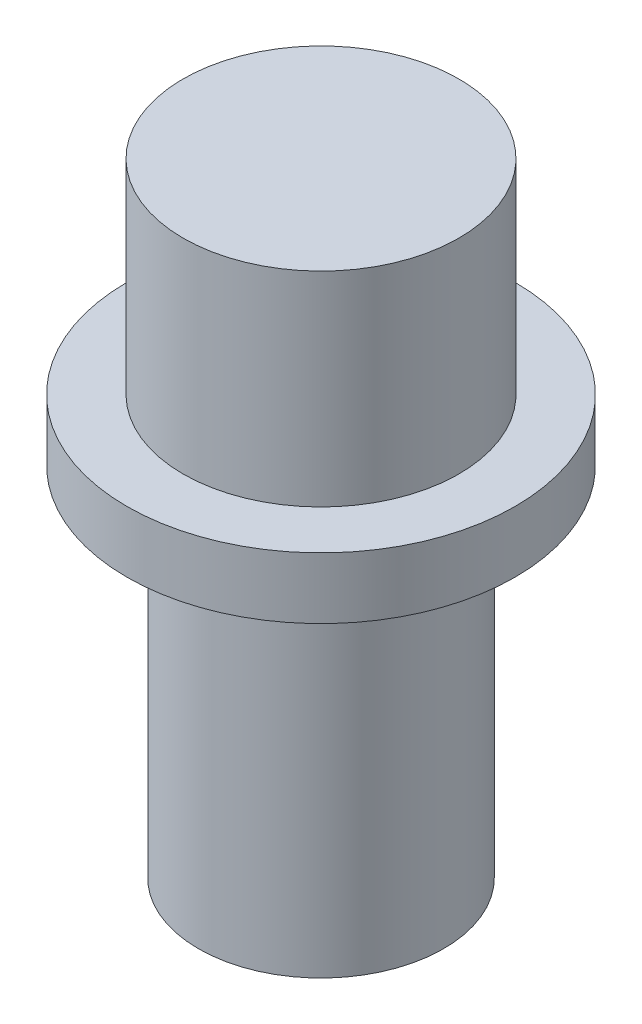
SolidWorks part; units mm, degrees
ref_plane "Front Plane" through (0, 0, 0) normal (0, 0, 1) x (1, 0, 0)
ref_plane "Top Plane" through (0, 0, 0) normal (0, 1, 0) x (1, 0, 0)
ref_plane "Right Plane" through (0, 0, 0) normal (1, 0, 0) x (0, 0, -1)
sketch "Sketch1" plane through (0, 0, 0) normal (0, 1, 0) x (1, 0, 0)
  circle A0 centre (0, 0) radius 12
  dimension "24" = 24
extrude "Boss-Extrude1" add sketch "Sketch1" along normal blind 35
sketch "Sketch2" plane through (0, 35, 0) normal (0, 1, 0) x (1, 0, 0)
  circle A0 centre (0, 0) radius 19
  dimension "D1" = 38
extrude "Boss-Extrude2" add sketch "Sketch2" along normal blind 6
sketch "Sketch3" plane through (0, 41, 0) normal (0, 1, 0) x (1, 0, 0)
  circle A0 centre (0, 0) radius 13.5
  dimension "D1" = 27
extrude "Boss-Extrude3" add sketch "Sketch3" along normal blind 20
